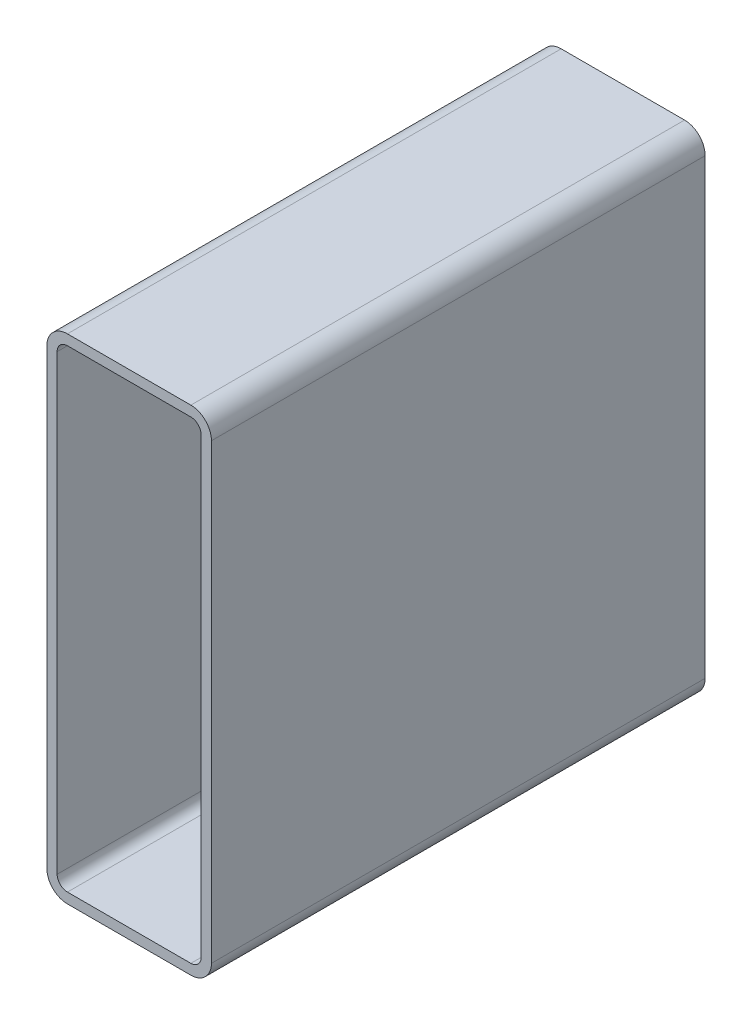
SolidWorks part; units mm, degrees
ref_plane "Front Plane" through (0, 0, 0) normal (0, 0, 1) x (1, 0, 0)
ref_plane "Top Plane" through (0, 0, 0) normal (0, 1, 0) x (1, 0, 0)
ref_plane "Right Plane" through (0, 0, 0) normal (1, 0, 0) x (0, 0, -1)
sketch "Sketch1" plane through (0, 0, 0) normal (0, 0, 1) x (1, 0, 0)
sketch_block_instance "HSS12x4x0.250-1"
sketch_block "HSS12x4x0.250"
extrude "Boss-Extrude1" add sketch "Sketch1" along normal blind 304.8
